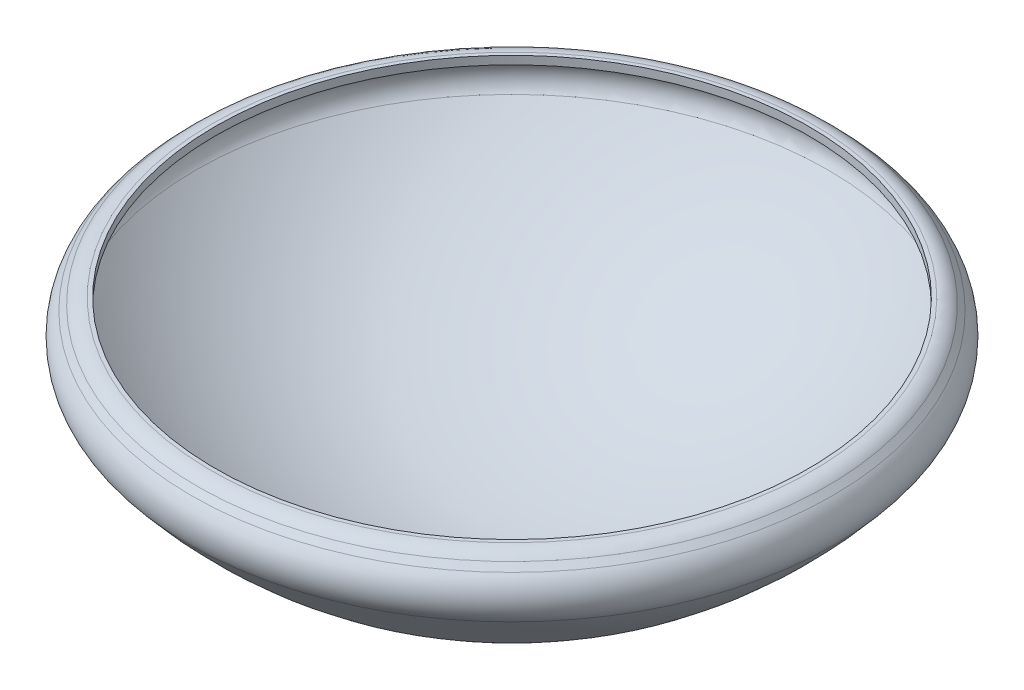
SolidWorks part; units mm, degrees
ref_plane "Face" through (0, 0, 0) normal (0, 0, 1) x (1, 0, 0)
ref_plane "Dessus" through (0, 0, 0) normal (0, 1, 0) x (1, 0, 0)
ref_plane "Droite" through (0, 0, 0) normal (1, 0, 0) x (0, 0, -1)
sketch "Esquisse1" plane through (0, 0, 0) normal (0, 0, 1) x (1, 0, 0)
  line L0 (0, 3.1069) -> (0, -3.1069) construction
  line L1 (7.6464, -0.1464) -> (7.7803, -0.2803)
  line L2 (7.2929, 0) -> (7.2, 0)
  arc A0 (7.2929, 0) -> (7.6464, -0.1464) centre (7.2929, -0.5) cw
  arc A1 (7.8309, -1.2851) -> (7.7803, -0.2803) centre (7.25, -0.8107) ccw
  arc A2 (0, -5) -> (7.8309, -1.2851) centre (0, 5.111) ccw
  dimension "D1" = 7.2
  dimension "D3" = 0.5
  dimension "D4" = 0.75
  dimension "D2" = 45
  dimension "D5" = 0.8107
  dimension "D6" = 7.25
  dimension "D7" = 5
revolve "Révol.-Mince3" add sketch "Esquisse1" angle 360 about L0
